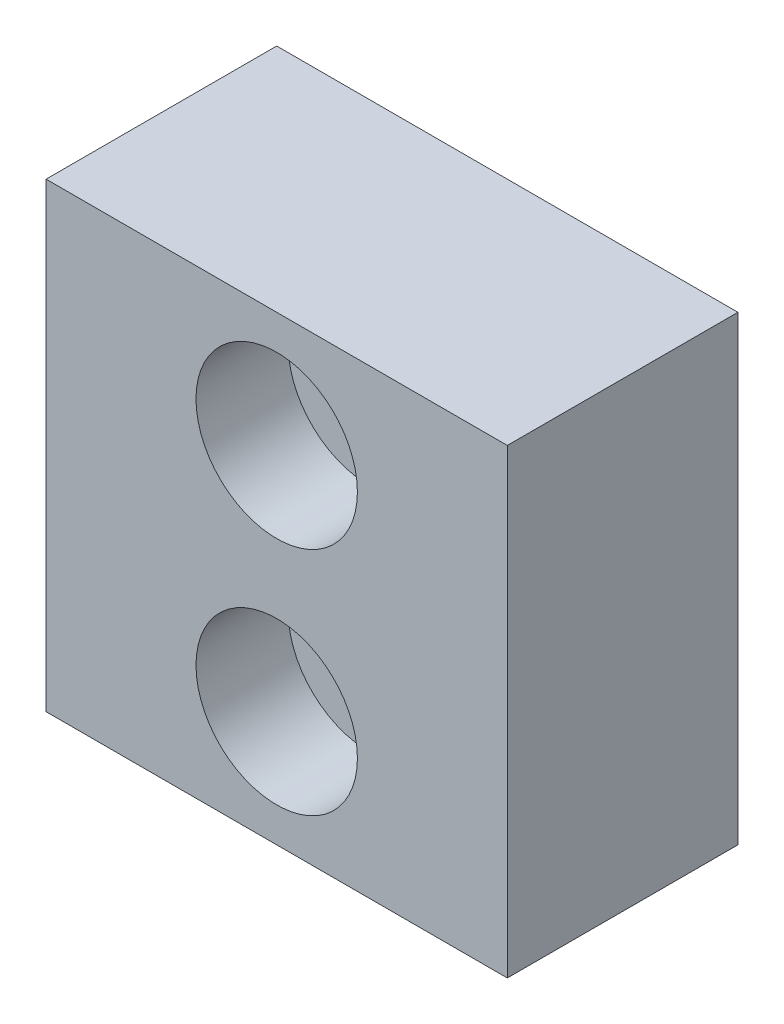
SolidWorks part; units mm, degrees
ref_plane "Front Plane" through (0, 0, 0) normal (0, 0, 1) x (1, 0, 0)
ref_plane "Top Plane" through (0, 0, 0) normal (0, 1, 0) x (1, 0, 0)
ref_plane "Right Plane" through (0, 0, 0) normal (1, 0, 0) x (0, 0, -1)
sketch "Sketch1" plane through (0, 0, 0) normal (0, 0, 1) x (1, 0, 0)
  line L1 (-10, 10) -> (10, 10)
  line L2 (-10, 10) -> (-10, -10)
  line L3 (-10, -10) -> (10, -10)
  line L4 (10, 10) -> (10, -10)
  line L5 (-10, 10) -> (10, -10) construction
  line L6 (-10, -10) -> (10, 10) construction
  point P0 (0, 0)
  dimension "D1" = 20
extrude "Boss-Extrude1" add sketch "Sketch1" along normal mid plane 10
sketch "Sketch2" plane through (0, 0, 5) normal (0, 0, 1) x (1, 0, 0)
  line L0 (-10, 0) -> (10, 0) construction
  line L1 (-10, 10) -> (-10, -10) construction
  line L2 (10, -10) -> (10, 10) construction
  circle A0 centre (0, 5) radius 2
  circle A1 centre (0, -5) radius 2
  dimension "D1" = 4
  dimension "D2" = 10
extrude "Cut-Extrude1" cut sketch "Sketch2" against normal blind 10
sketch "Sketch3" plane through (0, 0, 5) normal (0, 0, 1) x (1, 0, 0)
  circle A0 centre (0, 5) radius 3.5
  circle A1 centre (0, -5) radius 3.5
  dimension "D1" = 7
extrude "Cut-Extrude2" cut sketch "Sketch3" against normal blind 4
